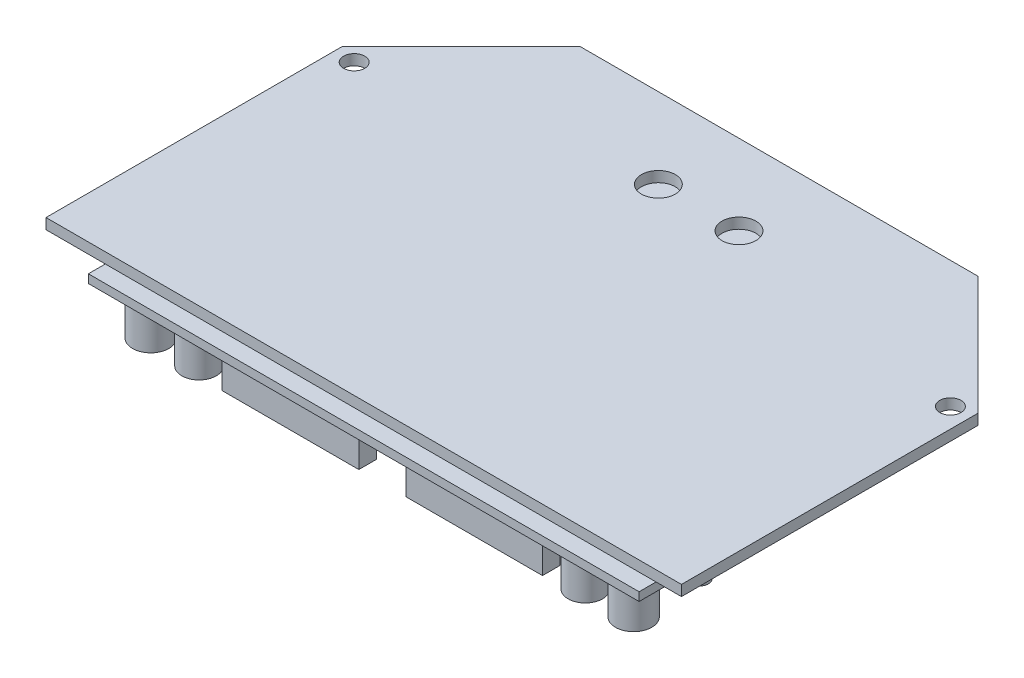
SolidWorks part; units mm, degrees
ref_plane "Plan de face" through (0, 0, 0) normal (0, 0, 1) x (1, 0, 0)
ref_plane "Plan de dessus" through (0, 0, 0) normal (0, 1, 0) x (1, 0, 0)
ref_plane "Plan de droite" through (0, 0, 0) normal (1, 0, 0) x (0, 0, -1)
sketch "Esquisse1" plane through (0, 0, 0) normal (0, 1, 0) x (1, 0, 0)
  line L0 (-85, -49) -> (0, -49)
  line L1 (0, -49) -> (0, 49)
  line L2 (0, 49) -> (-47, 49)
  line L3 (-47, 49) -> (-75, 21)
  line L4 (-75, 21) -> (-75, -29)
  line L5 (-75, -29) -> (-85, -29)
  line L6 (-85, -29) -> (-85, -49)
  line L7 (0, 49) -> (0, 95.7958) construction
  line L8 (-70.3686, 19.1158) -> (-75, 21) construction
  circle A0 centre (-9.513, 30.0613) radius 4
  circle A1 centre (-70.3686, 19.1158) radius 2.5
  circle A2 centre (-78, -38) radius 2.5
  dimension "D3" = 5
  dimension "D4" = 5
  dimension "D7" = 8
  dimension "D1" = 170
  dimension "D2" = 98
  dimension "D5" = 10
  dimension "D6" = 20
  dimension "D8" = 45
  dimension "D9" = 28
  dimension "D10" = 5
  dimension "D11" = 11
  dimension "D12" = 7
extrude "Boss.-Extru.1" add sketch "Esquisse1" against normal blind 2.5
sketch "Esquisse2" plane through (0, -2.5, 0) normal (0, -1, 0) x (1, 0, 0)
  line L0 (-65, 49) -> (-65, -12.6152)
  line L1 (-85, 49) -> (0, 49) construction
  line L2 (-65, -12.6152) -> (-28.6152, -49)
  line L3 (0, -49) -> (-47, -49) construction
  line L4 (-28.6152, -49) -> (0, -49)
  line L5 (0, -49) -> (0, 49)
  line L6 (0, 49) -> (-65, 49)
  line L7 (-47, -49) -> (-75, -21) construction
  line L8 (-75, -21) -> (-75, 29) construction
  dimension "D1" = 10
  dimension "D2" = 13
extrude "Boss.-Extru.2" add sketch "Esquisse2" along normal blind 2 from offset 4 separate body
sketch "Esquisse3" plane through (0, -8.5, 0) normal (0, -1, 0) x (1, 0, 0)
  line L0 (-37.8013, 44.6053) -> (-5.5529, 44.6053)
  line L1 (-37.8013, 44.6053) -> (-37.8013, 40.4274)
  line L2 (-5.5529, 44.6053) -> (-5.5529, 40.4274)
  line L3 (-37.8013, 40.4274) -> (-5.5529, 40.4274)
  circle A0 centre (-25.8966, -39.0838) radius 4.6875
  circle A1 centre (-10.8474, -39.0838) radius 4.5696
  circle A2 centre (-22.1341, 11.5735) radius 4.3889
  circle A3 centre (-10.8474, -14.8975) radius 3.919
  circle A4 centre (-37.8013, -22.2545) radius 1.5667
  circle A5 centre (-56.2103, 1.912) radius 1.9584
  circle A6 centre (-56.9937, 26.7355) radius 2.0935
  circle A7 centre (-48.1317, -10.059) radius 4.5733
  circle A8 centre (-52.705, 14.8401) radius 3.2666
  circle A9 centre (-49.4384, 24.4948) radius 2.4164
  circle A10 centre (-56.9937, 42.2799) radius 4.2887
  circle A11 centre (-45.5909, 42.2799) radius 4.0652
extrude "Boss.-Extru.3" add sketch "Esquisse3" along normal blind 10.5
sketch "Esquisse5" plane through (0, -2.5, 0) normal (0, -1, 0) x (1, 0, 0)
  line L0 (-64.7146, -23.5901) -> (-59.2916, -29.0131)
  line L1 (-71.0414, 42.5706) -> (-54.2301, 42.5706)
  line L2 (-71.0414, 42.5706) -> (-71.0414, 35.8823)
  line L3 (-71.0414, 35.8823) -> (-54.2301, 35.8823)
  line L4 (-54.2301, 42.5706) -> (-54.2301, 35.8823)
  line L5 (-71.0414, 27.7477) -> (-54.2301, 27.7477)
  line L6 (-71.0414, 27.7477) -> (-71.0414, 20.8786)
  line L7 (-71.0414, 20.8786) -> (-54.2301, 20.8786)
  line L8 (-54.2301, 27.7477) -> (-54.2301, 20.8786)
  line L9 (-71.0414, 14.0094) -> (-54.2301, 14.0094)
  line L10 (-71.0414, 14.0094) -> (-71.0414, 6.7788)
  line L11 (-71.0414, 6.7788) -> (-54.2301, 6.7788)
  line L12 (-54.2301, 14.0094) -> (-54.2301, 6.7788)
  line L13 (-71.0414, -1.175) -> (-54.2301, -1.175)
  line L14 (-71.0414, -1.175) -> (-71.0414, -8.7672)
  line L15 (-71.0414, -8.7672) -> (-54.2301, -8.7672)
  line L16 (-54.2301, -1.175) -> (-54.2301, -8.7672)
  line L17 (-64.7146, -23.5901) -> (-52.8744, -11.7499)
  line L18 (-59.2916, -29.0131) -> (-47.4513, -17.1729)
  line L19 (-52.8744, -11.7499) -> (-47.4513, -17.1729)
  line L20 (-53.3715, -36.2438) -> (-47.4513, -42.1639)
  line L21 (-53.3715, -36.2438) -> (-40.6952, -23.5675)
  line L22 (-47.4513, -42.1639) -> (-34.7751, -29.4876)
  line L23 (-40.6952, -23.5675) -> (-34.7751, -29.4876)
extrude "Boss.-Extru.4" add sketch "Esquisse5" along normal blind 3
mirror "Symétrie1" about plane through (0, 0, 0) normal (1, 0, 0) of "Boss.-Extru.4", "Boss.-Extru.2", "Boss.-Extru.1", "Boss.-Extru.3"
sketch "Esquisse6" plane through (0, -2.5, 0) normal (0, -1, 0) x (1, 0, 0)
  line L1 (-75, 29) -> (-85, 29)
  line L2 (-75, 29) -> (-75, 49)
  line L3 (-75, 49) -> (-85, 49)
  line L4 (-85, 29) -> (-85, 49)
  line L5 (75, 29) -> (85, 29)
  line L6 (75, 29) -> (75, 49)
  line L7 (75, 49) -> (85, 49)
  line L8 (85, 29) -> (85, 49)
extrude "Enlèv. mat.-Extru.1" cut sketch "Esquisse6" against normal through all
